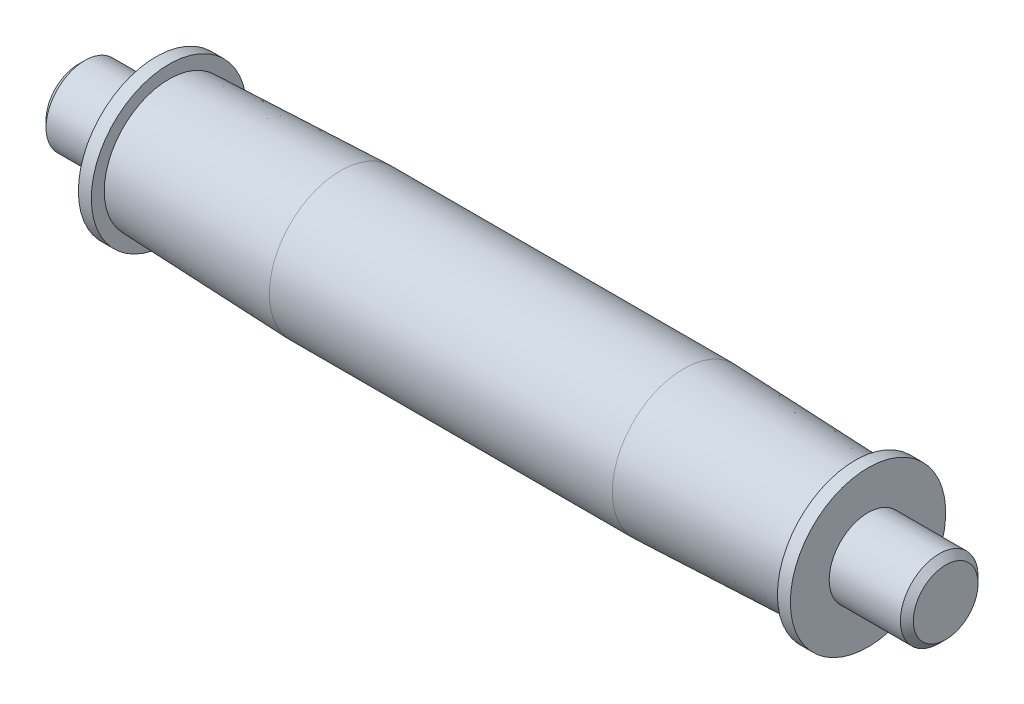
SolidWorks part; units mm, degrees
ref_plane "Alzado" through (0, 0, 0) normal (0, 0, 1) x (1, 0, 0)
ref_plane "Planta" through (0, 0, 0) normal (0, 1, 0) x (1, 0, 0)
ref_plane "Vista lateral" through (0, 0, 0) normal (1, 0, 0) x (0, 0, -1)
ref_plane "Plano1" through (0, 0, -300) normal (0, 0, -1) x (-1, 0, 0)
sketch "Croquis1" plane through (0, 0, -300) normal (0, 0, -1) x (-1, 0, 0)
  line L0 (-15.2239, -7.6119) -> (-15.2239, -13.9552)
  line L1 (-15.2239, -13.9552) -> (154.7761, -13.9552)
  line L2 (154.7761, -13.9552) -> (154.7761, -7.6119)
  line L3 (154.7761, -7.6119) -> (153.5075, -6.3433)
  line L4 (153.5075, -6.3433) -> (139.5522, -6.3433)
  line L5 (139.5522, -6.3433) -> (139.5522, 1.2687)
  line L6 (139.5522, 1.2687) -> (137.0149, 1.2687)
  line L7 (137.0149, 1.2687) -> (137.0149, -1.2687)
  line L8 (137.0149, -1.2687) -> (103.3955, 0)
  line L9 (103.3955, 0) -> (36.1567, 0)
  line L10 (36.1567, 0) -> (2.5373, -1.2687)
  line L11 (2.5373, -1.2687) -> (2.5373, 1.2687)
  line L12 (2.5373, 1.2687) -> (0, 1.2687)
  line L13 (0, 1.2687) -> (0, -6.3433)
  line L14 (0, -6.3433) -> (-13.9552, -6.3433)
  line L15 (-13.9552, -6.3433) -> (-15.2239, -7.6119)
  line L16 (-15.2239, -13.9552) -> (154.7761, -13.9552) construction
  dimension "D1" = 170
  dimension "D2" = 2.5373
  dimension "D3" = 36.1567
  dimension "D4" = 103.3955
  dimension "D5" = 153.5075
  dimension "D6" = 1.2687
  dimension "D7" = 6.3433
  dimension "D8" = 13.9552
revolve "Revolución1" add sketch "Croquis1" angle 360 about L16
